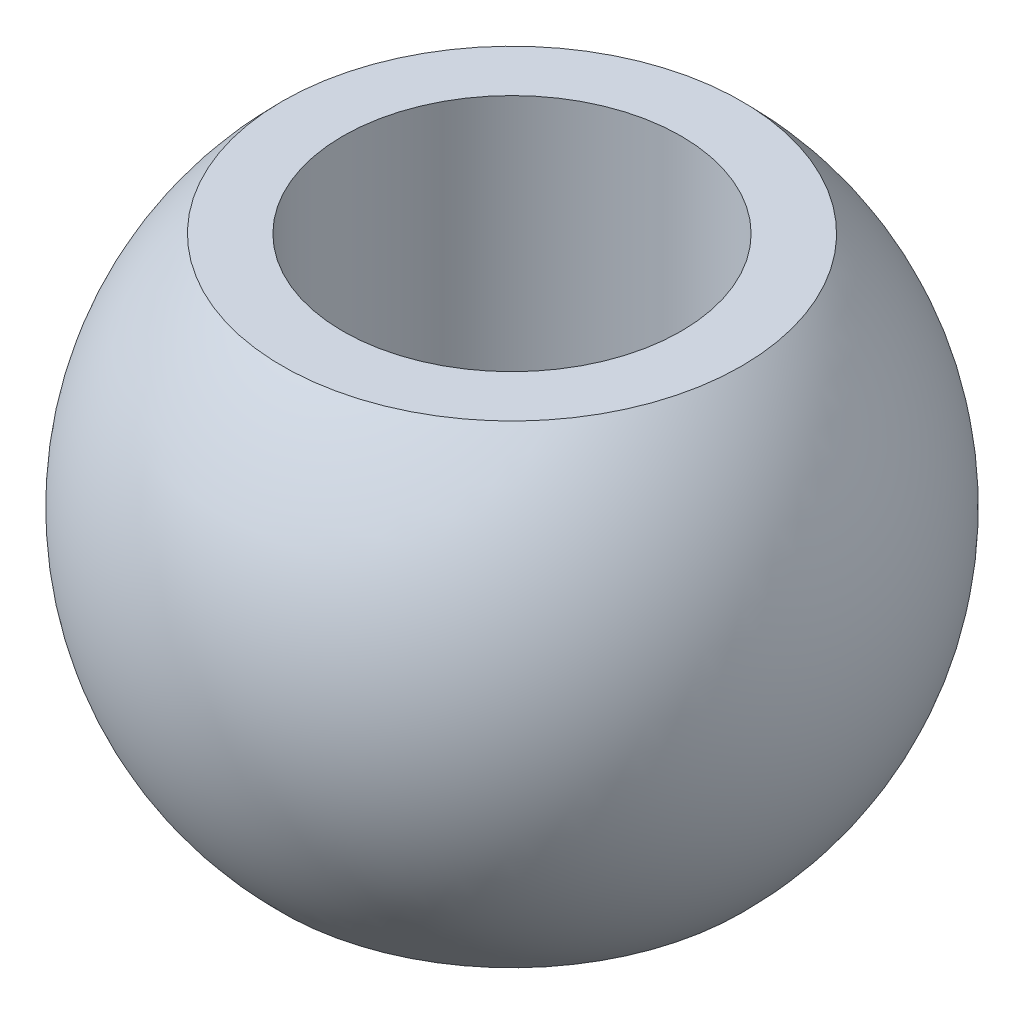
SolidWorks part; units mm, degrees
ref_plane "Face" through (0, 0, 0) normal (0, 0, 1) x (1, 0, 0)
ref_plane "Dessus" through (0, 0, 0) normal (0, 1, 0) x (1, 0, 0)
ref_plane "Droite" through (0, 0, 0) normal (1, 0, 0) x (0, 0, -1)
sketch "Esquisse1" plane through (0, 0, 0) normal (0, 0, 1) x (1, 0, 0)
  line L0 (0, 0) -> (0, 13.3332) construction
  line L1 (5, 7) -> (5, -7)
  line L2 (0, 0) -> (0, -11.2594) construction
  line L3 (5, 7) -> (6.7869, 7)
  line L4 (0, 0) -> (11.5635, 0) construction
  line L5 (5, -7) -> (6.7869, -7)
  arc A0 (6.7869, -7) -> (6.7869, 7) centre (0, 0) ccw
  dimension "D1" = 19.5
  dimension "D2" = 5
  dimension "D3" = 7
revolve "Révolution1" add sketch "Esquisse1" angle 360 about L0
